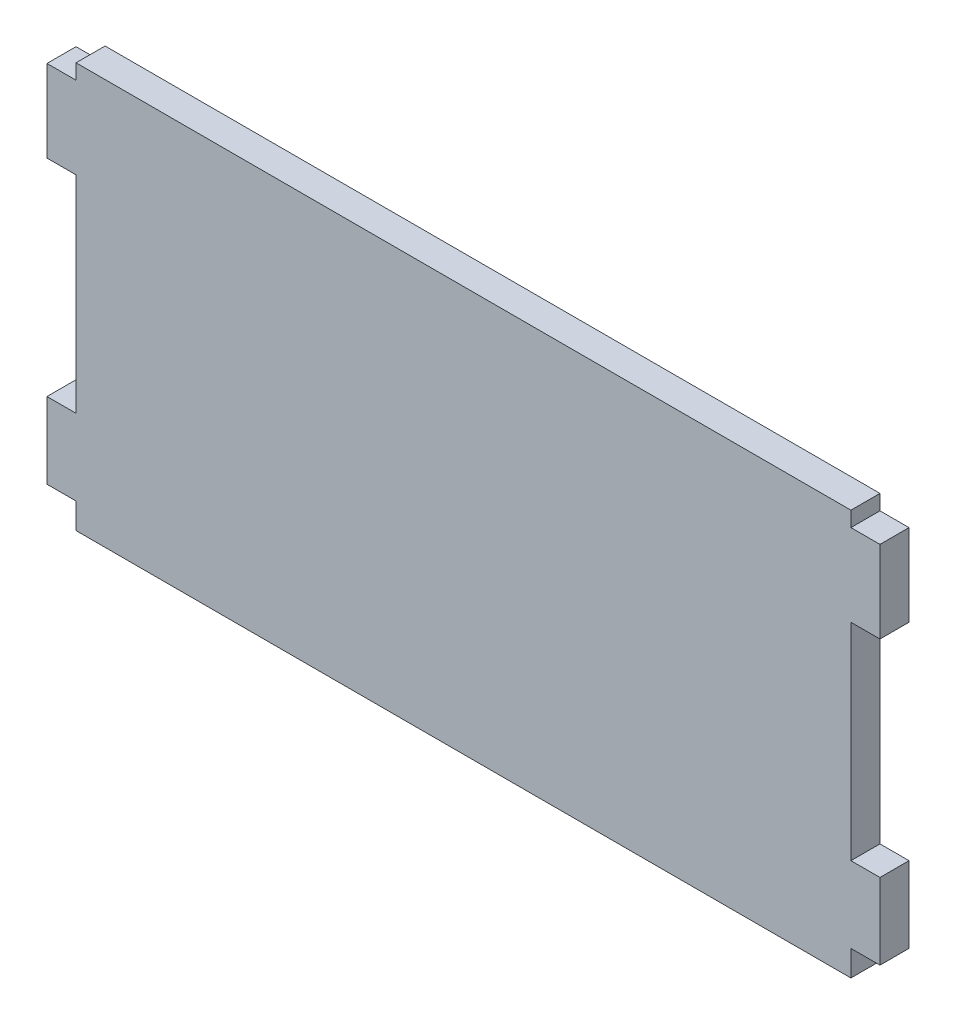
SolidWorks part; units mm, degrees
ref_plane "Plan de face" through (0, 0, 0) normal (0, 0, 1) x (1, 0, 0)
ref_plane "Plan de dessus" through (0, 0, 0) normal (0, 1, 0) x (1, 0, 0)
ref_plane "Plan de droite" through (0, 0, 0) normal (1, 0, 0) x (0, 0, -1)
sketch "Esquisse1" plane through (0, 0, 0) normal (0, 0, 1) x (1, 0, 0)
  line L0 (0, -14.8418) -> (0, 35.2858) construction
  line L1 (0, 14.0214) -> (80, 14.0214)
  line L2 (0, 14.0214) -> (0, -27.8081)
  line L3 (0, -27.8081) -> (80, -27.8081)
  line L4 (80, 14.0214) -> (80, -27.8081)
  line L5 (80, -19.958) -> (80, -67.1489) construction
extrude "Boss.-Extru.1" add sketch "Esquisse1" along normal blind 3
sketch "Esquisse2" plane through (0, 0, 3) normal (0, 0, 1) x (1, 0, 0)
  line L0 (-3, 12.4619) -> (0, 12.4619) construction
  line L1 (-3, 3.999) -> (0, 3.999) construction
  line L2 (-3, 12.4619) -> (0, 12.4619)
  line L3 (-3, 3.999) -> (0, 3.999)
  line L4 (-3, -17.3181) -> (0, -17.3181) construction
  line L5 (-3, -25.1623) -> (0, -25.1623) construction
  line L6 (-3, -17.3181) -> (0, -17.3181)
  line L7 (-3, -25.1623) -> (0, -25.1623)
  line L8 (0, 12.4619) -> (0, 3.999)
  line L9 (0, -17.3181) -> (0, -25.1623)
  line L10 (-3, -17.3181) -> (-3, -25.1623)
  line L12 (-3, 12.4619) -> (-3, 3.999)
  line L13 (40, 14.0214) -> (40, -27.8081) construction
  line L14 (80, 14.0214) -> (0, 14.0214) construction
  line L15 (0, -27.8081) -> (80, -27.8081) construction
  line L16 (83, 12.4619) -> (83, 3.999)
  line L17 (83, -17.3181) -> (83, -25.1623)
  line L18 (80, -17.3181) -> (80, -25.1623)
  line L19 (80, 12.4619) -> (80, 3.999)
  line L20 (83, -25.1623) -> (80, -25.1623)
  line L21 (83, -17.3181) -> (80, -17.3181)
  line L22 (83, 3.999) -> (80, 3.999)
  line L23 (83, 12.4619) -> (80, 12.4619)
extrude "Boss.-Extru.2" add sketch "Esquisse2" against normal blind 3
